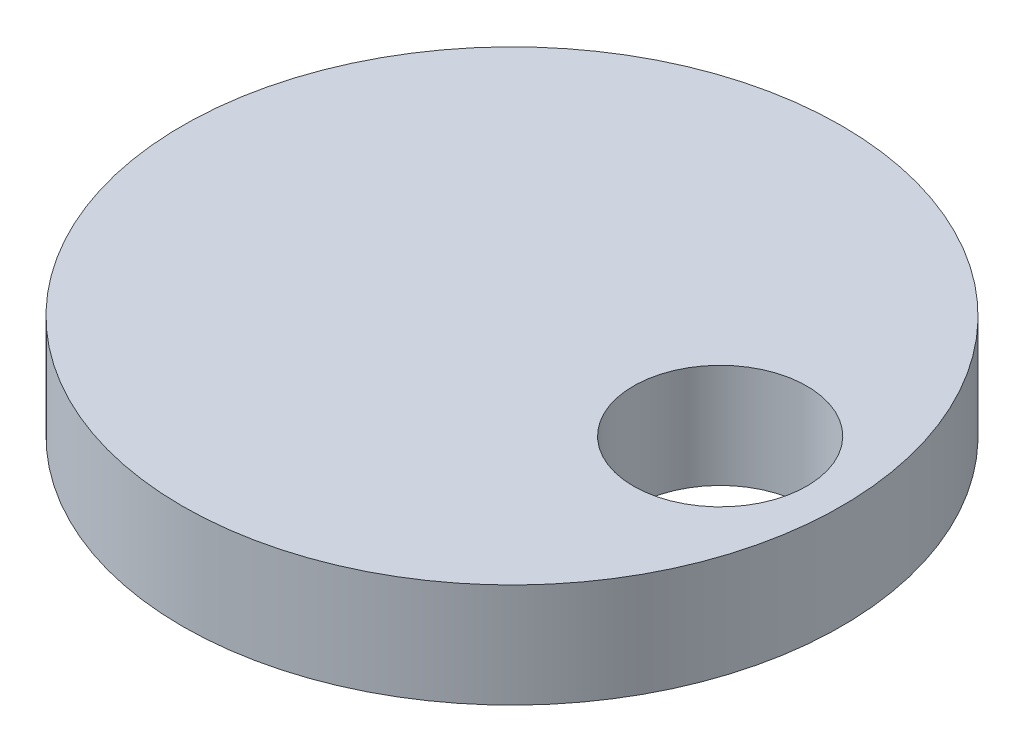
SolidWorks part; units mm, degrees
ref_plane "Front Plane" through (0, 0, 0) normal (0, 0, 1) x (1, 0, 0)
ref_plane "Top Plane" through (0, 0, 0) normal (0, 1, 0) x (1, 0, 0)
ref_plane "Right Plane" through (0, 0, 0) normal (1, 0, 0) x (0, 0, -1)
sketch "Sketch1" plane through (0, 0, 0) normal (0, 1, 0) x (1, 0, 0)
  circle A0 centre (0, 0) radius 9.5
  dimension "D1" = 19
extrude "Extrude1" add sketch "Sketch1" along normal blind 3
sketch "Sketch2" plane through (0, 3, 0) normal (0, 1, 0) x (1, 0, 0)
  line L0 (0, 0) -> (9.5, 0) construction
  circle A0 centre (0, 0) radius 9.5 construction
  point P6 (6, 0)
  dimension "D1" = 6
hole_wizard "M6 Tapped Hole1" positions "3DSketch1" profile "Sketch4" tap size "M6" standard "ISO"
sketch3d "3DSketch1"
  point P0 (6, 3, 0)
sketch "Sketch4" plane through (6, 3, 0) normal (1, 0, 0) x (0, 0, 1)
  line L0 (0, 0) -> (0, 3)
  line L1 (0, 3) -> (2.5, 3)
  line L2 (2.5, 3) -> (2.5, 0)
  line L5 (2.5, 0) -> (0, 0)
  line L11 (0, -6.35) -> (0, 107.95) construction
  dimension "Thru Tap Drill Dia." = 5
  dimension "Thru Tap Drill Depth" = 3
